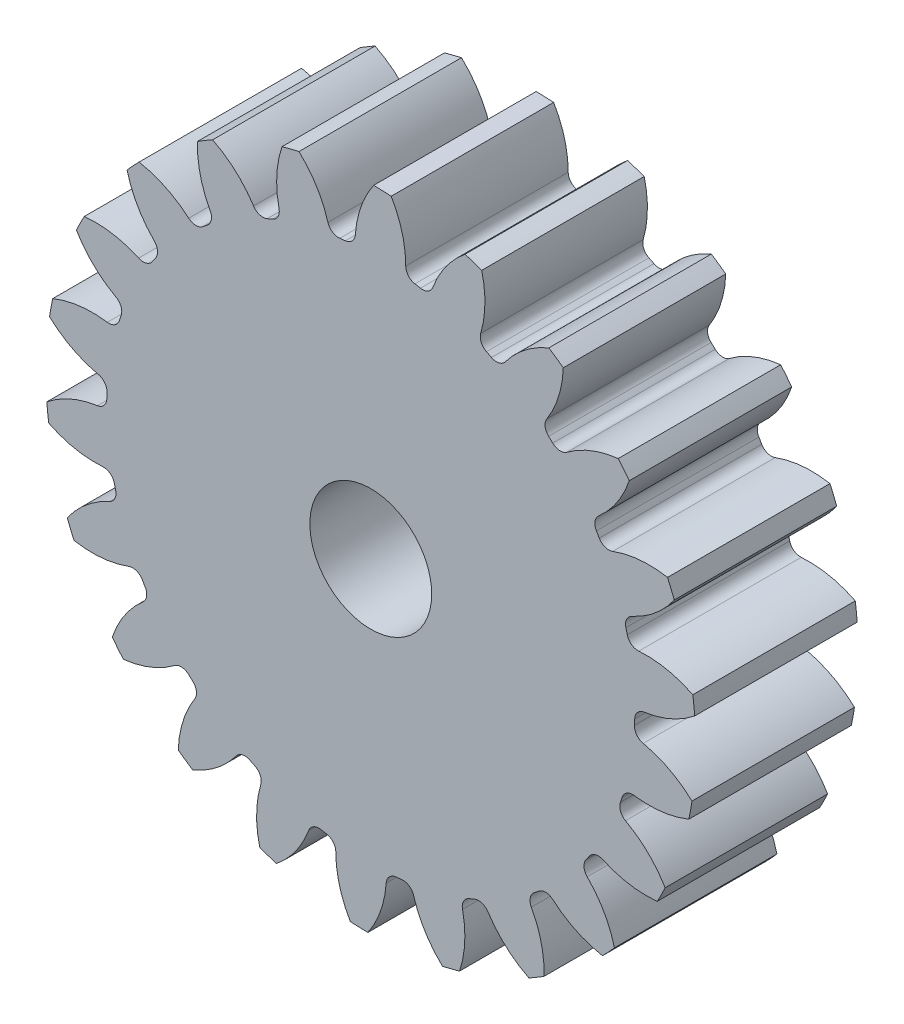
SolidWorks part; units mm, degrees
ref_plane "Front" through (0, 0, 0) normal (0, 0, 1) x (1, 0, 0)
ref_plane "Top" through (0, 0, 0) normal (0, 1, 0) x (1, 0, 0)
ref_plane "Right" through (0, 0, 0) normal (1, 0, 0) x (0, 0, -1)
sketch "Sketch3" plane through (0, 0, 0) normal (0, 0, 1) x (1, 0, 0)
  circle A0 centre (0, 0) radius 203.2
  dimension "od" = 406.4
extrude "gearBody" add sketch "Sketch3" along normal blind 101.6
sketch "Sketch2" plane through (0, 0, 0) normal (0, 0, 1) x (1, 0, 0)
  line L0 (0, 0) -> (161.7098, 66.9824) construction
  line L1 (201.478, -31.261) -> (0, 0) construction
  line L2 (0, 0) -> (36.3143, 0) construction
  line L3 (186.1502, 6.5845) -> (185.2001, -19.9051) construction
  line L5 (185.6752, -6.6603) -> (0, 0) construction
  line L7 (0, 0) -> (175.0334, 0) construction
  arc A0 (175.0042, 3.1976) -> (174.3253, -15.7283) centre (0, 0) ccw construction
  arc A1 (202.5519, 16.2166) -> (200.8694, -30.6876) centre (0, 0) ccw construction
  arc A2 (186.1502, 6.5845) -> (185.2001, -19.9051) centre (0, 0) ccw construction
  arc A3 (164.9215, -7.6745) -> (165.0475, -4.1617) centre (0, 0) ccw
  arc A4 (201.478, -31.261) -> (170.3413, -14.7293) centre (156.4949, -78.3966) ccw
  arc A5 (201.478, -31.261) -> (203.2, 16.7449) centre (0, 0) ccw
  arc A6 (203.2, 16.7449) -> (170.9589, 2.4867) centre (161.7098, 66.9824) cw
  arc A7 (165.0475, -4.1617) -> (170.9589, 2.4867) centre (171.9372, -4.3354) cw
  arc A8 (170.3413, -14.7293) -> (164.9215, -7.6745) centre (171.8059, -7.9949) cw
  point P6 (203.2, 16.7449)
  point P22 (201.478, -31.261)
  dimension "baseDia" = 350.0668
  dimension "od" = 406.4
  dimension "pd" = 372.5333
  dimension "rd" = 330.2
  dimension "rFillet" = 6.8919
  dimension "pointX" = 203.2
  dimension "pointY" = 16.7449
  dimension "CTT" = 26.4896
  dimension "flankCenterAngle" = 22.5
extrude "toothCut" cut sketch "Sketch2" along normal through all
pattern_circular "CirPattern1" count 22 over 360 about axis through (0, 0, 0) along (0, 0, 1) of "toothCut"
sketch "hub1Dia" plane through (0, 0, 0) normal (0, 0, -1) x (-1, 0, 0)
  circle A0 centre (0, 0) radius 12.7
  dimension "hub1Dia" = 25.4
sketch "hub2Dia" plane through (0, 0, 101.6) normal (0, 0, 1) x (1, 0, 0)
  circle A0 centre (0, 0) radius 12.7
  dimension "hub2dia" = 25.4
sketch "boreDia" plane through (0, 0, 0) normal (0, 0, 1) x (1, 0, 0)
  circle A0 centre (0, 0) radius 38.1
  dimension "boreDia" = 76.2
extrude "bore" cut sketch "boreDia" against normal mid plane 25400
